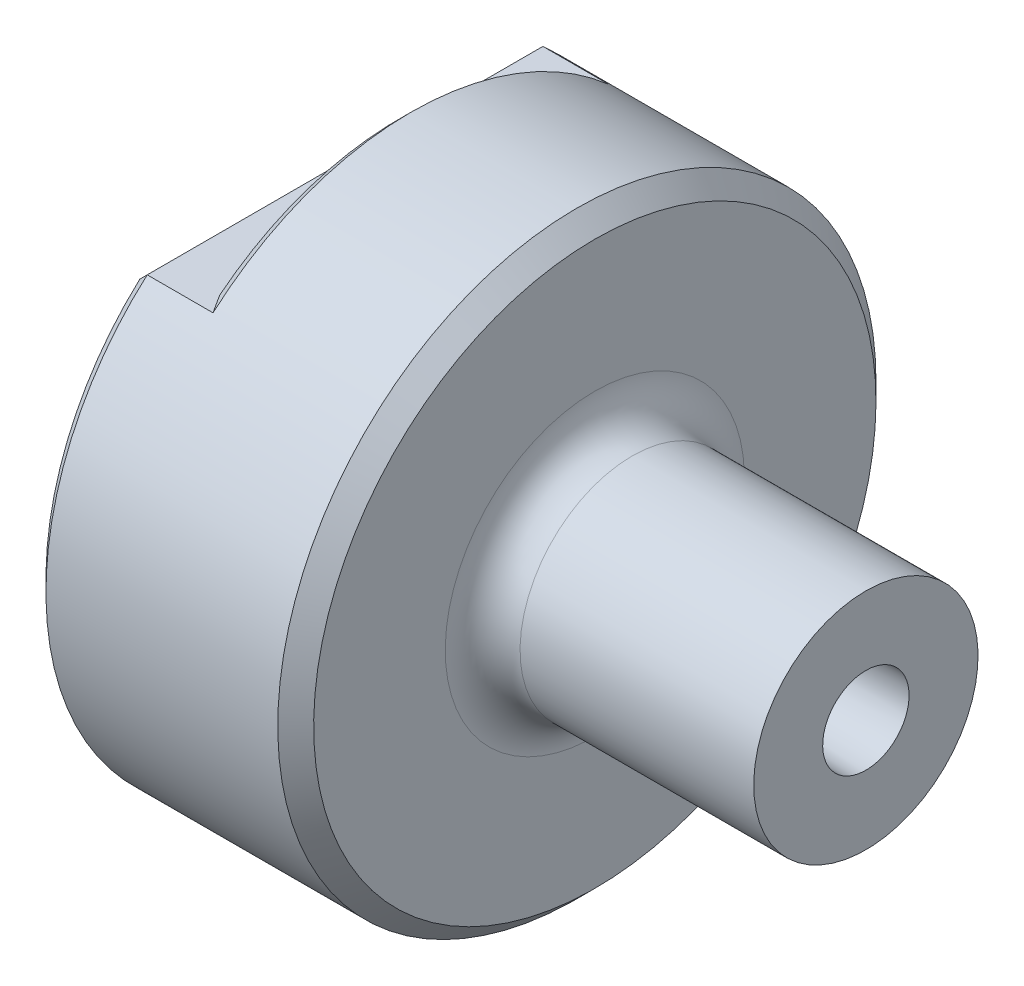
SolidWorks part; units mm, degrees
ref_plane "Front Plane" through (0, 0, 0) normal (0, 0, 1) x (1, 0, 0)
ref_plane "Top Plane" through (0, 0, 0) normal (0, 1, 0) x (1, 0, 0)
ref_plane "Right Plane" through (0, 0, 0) normal (1, 0, 0) x (0, 0, -1)
sketch "Sketch1" plane through (0, 0, 0) normal (1, 0, 0) x (0, 0, -1)
  circle A0 centre (0, 0) radius 25.4
  dimension "Rod Dia" = 50.8
extrude "Boss-Extrude1" add sketch "Sketch1" along normal mid plane 45.2437 contours A0
sketch "Sketch3" plane through (-22.6219, 0, 0) normal (-1, 0, 0) x (0, 0, 1)
  line L1 (-25.4, 25.4) -> (25.4, 25.4)
  line L2 (-25.4, 25.4) -> (-25.4, 19.05)
  line L3 (-25.4, 19.05) -> (25.4, 19.05)
  line L4 (25.4, 25.4) -> (25.4, 19.05)
  line L5 (-25.4, 25.4) -> (25.4, 19.05) construction
  line L6 (-25.4, 19.05) -> (25.4, 25.4) construction
  circle A0 centre (0, 0) radius 25.4 construction
  point P0 (0, 22.225)
  dimension "D1" = 19.05
extrude "Cut-Extrude1" cut sketch "Sketch3" against normal blind 5.588
sketch "Sketch5" plane through (0, 0, 0) normal (0, 0, 1) x (1, 0, 0)
  line L0 (22.6219, 0) -> (-22.6219, 0) construction
  line L1 (22.6219, -25.4) -> (22.6219, 25.4) construction
  line L2 (-22.6219, 19.05) -> (-22.6219, -25.4) construction
  line L3 (-0.3969, -9.525) -> (22.6219, -9.525)
  line L4 (22.6219, -9.525) -> (22.6219, -25.4)
  line L5 (22.6219, -25.4) -> (-0.3969, -25.4)
  line L6 (-22.6219, -25.4) -> (22.6219, -25.4) construction
  line L7 (-0.3969, -25.4) -> (-0.3969, -9.525)
  dimension "B" = 22.225
  dimension "D" = 19.05
revolve "Cut-Revolve1" cut sketch "Sketch5" angle 360 about L0
sketch "Sketch6" plane through (0, 0, 0) normal (0, 0, 1) x (1, 0, 0)
  line L0 (22.6219, 0) -> (-22.6219, 0) construction
  line L1 (22.6219, -9.525) -> (22.6219, 9.525) construction
  line L2 (-22.6219, 19.05) -> (-22.6219, -25.4) construction
  line L3 (-17.9991, 0) -> (-22.6219, 0)
  line L5 (-22.6219, 12.4402) -> (-22.6219, 0)
  arc A0 (-22.6219, 12.4402) -> (-17.9991, 0) centre (-37.0491, 0) cw
  dimension "D1" = 19.05
  dimension "D2" = 4.6228
revolve "Cut-Revolve2" cut sketch "Sketch6" angle 360 about L0
sketch "Sketch7" plane through (0, 0, 0) normal (0, 0, 1) x (1, 0, 0)
  line L0 (-18.2027, 2.7781) -> (22.6219, 3.6689)
  line L2 (22.6219, -9.525) -> (22.6219, 9.525) construction
  line L3 (-18.2027, 0) -> (22.6219, 0)
  line L4 (22.6219, 0) -> (-22.6219, 0) construction
  line L5 (-22.6219, 19.05) -> (-22.6219, -25.4) construction
  line L6 (22.6219, 3.6689) -> (22.6219, 0)
  line L7 (-18.2027, 2.7781) -> (-18.2027, 0)
  line L8 (22.6219, 0) -> (41.1743, 0.1051)
  arc A1 (-22.6219, -12.4402) -> (-22.6219, 12.4402) centre (-37.0491, 0) ccw construction
  dimension "D1" = 1.25
  dimension "D2" = 5.5562
revolve "Cut-Revolve3" cut sketch "Sketch7" angle 360 about L4
fillet "Fillet1" radius 3.175 1 edges at (-0.3969, 9.525, 0)
chamfer "Chamfer1" distance 1.524 angle 45 1 edges at (-0.3969, 25.4, 0)
chamfer "Chamfer2" distance 1.016 angle 45 3 edges at (-17.0339, 25.4, 0) (-22.6219, -25.4, 0) (-22.6219, 19.05, 0)
